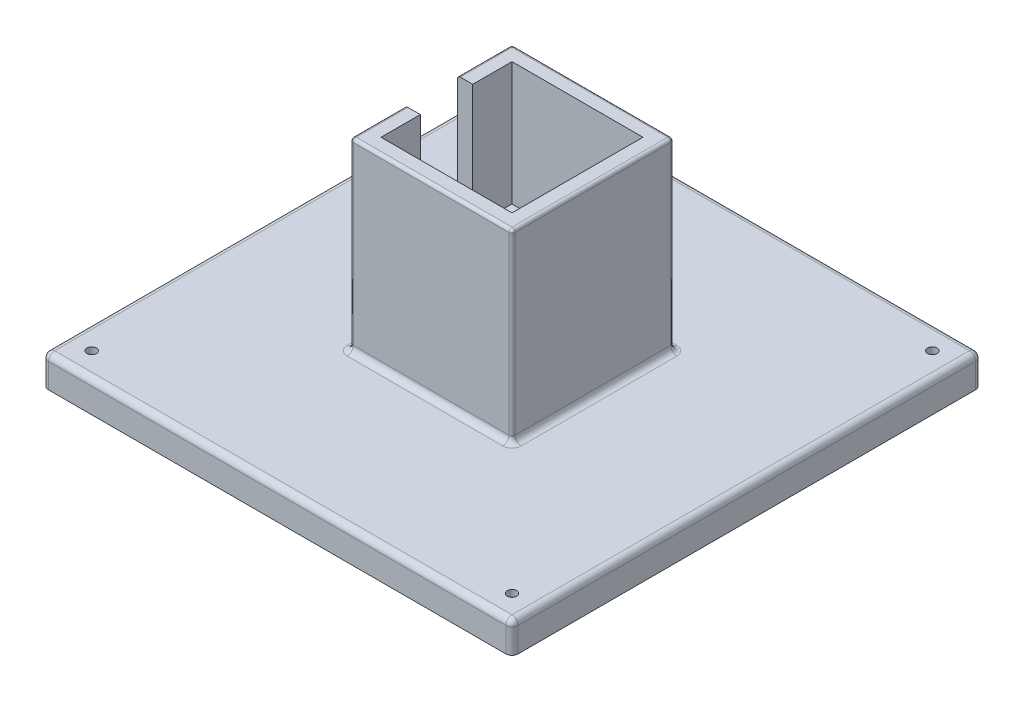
SolidWorks part; units mm, degrees
ref_plane "Front Plane" through (0, 0, 0) normal (0, 0, 1) x (1, 0, 0)
ref_plane "Top Plane" through (0, 0, 0) normal (0, 1, 0) x (1, 0, 0)
ref_plane "Right Plane" through (0, 0, 0) normal (1, 0, 0) x (0, 0, -1)
sketch "Sketch1" plane through (0, 0, 0) normal (0, 1, 0) x (1, 0, 0)
  line L0 (-26.25, -26.25) -> (-26.25, 26.25)
  line L1 (-21.25, -21.25) -> (21.25, -21.25)
  line L2 (-21.25, -21.25) -> (-21.25, 21.25)
  line L3 (-21.25, 21.25) -> (21.25, 21.25)
  line L4 (21.25, -21.25) -> (21.25, 21.25)
  line L5 (-21.25, -21.25) -> (21.25, 21.25) construction
  line L6 (-21.25, 21.25) -> (21.25, -21.25) construction
  line L7 (-26.25, 26.25) -> (26.25, 26.25)
  line L8 (26.25, -26.25) -> (26.25, 26.25)
  line L9 (-26.25, -26.25) -> (26.25, -26.25)
  point P0 (0, 0)
  dimension "D1" = 42.5
  dimension "D2" = 42.5
  dimension "D3" = 5
extrude "Boss-Extrude1" add sketch "Sketch1" along normal blind 60
ref_plane "Plane1" through (0, 5, 0) normal (0, 1, 0) x (1, 0, 0)
sketch "Sketch4" plane through (0, 5, 0) normal (0, 1, 0) x (1, 0, 0)
  line L1 (-21.25, -21.25) -> (21.25, -21.25)
  line L2 (-21.25, -21.25) -> (-21.25, 21.25)
  line L3 (-21.25, 21.25) -> (21.25, 21.25)
  line L4 (21.25, -21.25) -> (21.25, 21.25)
  line L5 (-21.25, -21.25) -> (21.25, 21.25) construction
  line L6 (-21.25, 21.25) -> (21.25, -21.25) construction
  circle A0 centre (0, 0) radius 2.69
  point P0 (0, 0)
  dimension "D1" = 5.38
extrude "Boss-Extrude3" add sketch "Sketch4" along normal blind 15
sketch "Sketch6" plane through (0, 5, 0) normal (0, -1, 0) x (1, 0, 0)
  line L1 (-21.25, -21.25) -> (21.25, -21.25)
  line L2 (-21.25, -21.25) -> (-21.25, 21.25)
  line L3 (-21.25, 21.25) -> (21.25, 21.25)
  line L4 (21.25, -21.25) -> (21.25, 21.25)
extrude "Boss-Extrude6" add sketch "Sketch6" along normal blind 5
sketch "Sketch8" plane through (0, 20, 0) normal (0, 1, 0) x (1, 0, 0)
  line L0 (0, 21.25) -> (0, -21.25) construction
  line L1 (21.25, 21.25) -> (-21.25, 21.25) construction
  line L2 (-21.25, -21.25) -> (21.25, -21.25) construction
  line L3 (-21.25, 0) -> (21.25, 0) construction
  line L4 (-21.25, 21.25) -> (-21.25, -21.25) construction
  line L5 (21.25, -21.25) -> (21.25, 21.25) construction
  circle A0 centre (-15.5, 15.5) radius 1.5
  circle A1 centre (15.5, 15.5) radius 1.5
  circle A2 centre (15.5, -15.5) radius 1.5
  circle A3 centre (-15.5, -15.5) radius 1.5
  dimension "D1" = 3
  dimension "D2" = 15.5
  dimension "D3" = 15.5
extrude "Cut-Extrude2" cut sketch "Sketch8" against normal blind 4.5 contours A0 | A1 | A2 | A3
thread "Thread1" pitch 0.5 start angle 0, offset 0, length 4.5, pitch 0.5, diameter 3
ref_plane "Plane4" through (-17, 20, -15.5) normal (0, 0, 1) x (-1, 0, 0)
sketch "Thread Profile3" plane through (-17, 20, -15.5) normal (0, 0, 1) x (-1, 0, 0)
  line L0 (0, 0) -> (0, 0.5) construction
  line L1 (0, 0) -> (0.2706, 0.1562)
  line L2 (0.2706, 0.1562) -> (0.2706, 0.2187)
  line L3 (0.2706, 0.2187) -> (0, 0.375)
  line L4 (0.2706, 0.1875) -> (0, 0.1875) construction
  line L11 (0, 0) -> (0, 0.375)
  point P2 (0, 0)
  dimension "Pitch" = 0.5
  dimension "Profile_Angle" = 60
  dimension "Profile_Land" = 0.0625
  dimension "Profile_Height" = 0.2706
thread "Thread2" pitch 0.5 start angle 0, offset 0, length 4.5, pitch 0.5, diameter 3
ref_plane "Plane5" through (14, 20, -15.5) normal (0, 0, 1) x (-1, 0, 0)
sketch "Thread Profile4" plane through (14, 20, -15.5) normal (0, 0, 1) x (-1, 0, 0)
  line L0 (0, 0) -> (0, 0.5) construction
  line L1 (0, 0) -> (0.2706, 0.1562)
  line L2 (0.2706, 0.1562) -> (0.2706, 0.2187)
  line L3 (0.2706, 0.2187) -> (0, 0.375)
  line L4 (0.2706, 0.1875) -> (0, 0.1875) construction
  line L11 (0, 0) -> (0, 0.375)
  point P2 (0, 0)
  dimension "Pitch" = 0.5
  dimension "Profile_Angle" = 60
  dimension "Profile_Land" = 0.0625
  dimension "Profile_Height" = 0.2706
thread "Thread3" pitch 0.5 start angle 0, offset 0, length 4.5, pitch 0.5, diameter 3
ref_plane "Plane6" through (-17, 20, 15.5) normal (0, 0, 1) x (-1, 0, 0)
sketch "Thread Profile5" plane through (-17, 20, 15.5) normal (0, 0, 1) x (-1, 0, 0)
  line L0 (0, 0) -> (0, 0.5) construction
  line L1 (0, 0) -> (0.2706, 0.1562)
  line L2 (0.2706, 0.1562) -> (0.2706, 0.2187)
  line L3 (0.2706, 0.2187) -> (0, 0.375)
  line L4 (0.2706, 0.1875) -> (0, 0.1875) construction
  line L11 (0, 0) -> (0, 0.375)
  point P2 (0, 0)
  dimension "Pitch" = 0.5
  dimension "Profile_Angle" = 60
  dimension "Profile_Land" = 0.0625
  dimension "Profile_Height" = 0.2706
thread "Thread4" pitch 0.5 start angle 0, offset 0, length 4.5, pitch 0.5, diameter 3
ref_plane "Plane7" through (14, 20, 15.5) normal (0, 0, 1) x (-1, 0, 0)
sketch "Thread Profile6" plane through (14, 20, 15.5) normal (0, 0, 1) x (-1, 0, 0)
  line L0 (0, 0) -> (0, 0.5) construction
  line L1 (0, 0) -> (0.2706, 0.1562)
  line L2 (0.2706, 0.1562) -> (0.2706, 0.2187)
  line L3 (0.2706, 0.2187) -> (0, 0.375)
  line L4 (0.2706, 0.1875) -> (0, 0.1875) construction
  line L11 (0, 0) -> (0, 0.375)
  point P2 (0, 0)
  dimension "Pitch" = 0.5
  dimension "Profile_Angle" = 60
  dimension "Profile_Land" = 0.0625
  dimension "Profile_Height" = 0.2706
fillet "Fillet1" radius 1 8 edges at (-26.25, 60, 0) (0, 60, 26.25) (26.25, 60, 0) (0, 60, -26.25) (26.25, 30, -26.25) (26.25, 30, 26.25) (-26.25, 30, 26.25) (-26.25, 30, -26.25)
sketch "Sketch10" plane through (0, 20, 0) normal (0, 1, 0) x (1, 0, 0)
  circle A0 centre (0, 0) radius 8.19
  dimension "D1" = 16.38
extrude "Cut-Extrude4" cut sketch "Sketch10" against normal blind 5
sketch "Sketch11" plane through (0, 60, 0) normal (0, 1, 0) x (1, 0, 0)
  line L0 (-26.25, -25.25) -> (-26.25, 25.25) construction
  line L1 (-21.25, 8.5) -> (-26.25, 8.5)
  line L2 (-21.25, 8.5) -> (-21.25, -8.5)
  line L3 (-21.25, -8.5) -> (-26.25, -8.5)
  line L4 (-26.25, 8.5) -> (-26.25, -8.5)
  point P4 (-21.25, 0)
  dimension "D2" = 17
  dimension "D3" = 5
extrude "Cut-Extrude5" cut sketch "Sketch11" against normal blind 36
sketch "Sketch12" plane through (0, 0, 0) normal (0, -1, 0) x (1, 0, 0)
  line L1 (-76.2, -76.2) -> (76.2, -76.2)
  line L2 (-76.2, -76.2) -> (-76.2, 76.2)
  line L3 (-76.2, 76.2) -> (76.2, 76.2)
  line L4 (76.2, -76.2) -> (76.2, 76.2)
  line L5 (-76.2, -76.2) -> (76.2, 76.2) construction
  line L6 (-76.2, 76.2) -> (76.2, -76.2) construction
  point P0 (0, 0)
  dimension "D1" = 152.4
  dimension "D2" = 152.4
extrude "Boss-Extrude7" add sketch "Sketch12" along normal blind 10
fillet "Fillet2" radius 2 16 edges at (-25.9571, 0, -25.9571) (-26.25, 0, 0) (-25.9571, 0, 25.9571) (0, 0, 26.25) (25.9571, 0, 25.9571) (26.25, 0, 0) (25.9571, 0, -25.9571) (0, 0, -26.25) (0, 0, 76.2) (-76.2, 0, 0) (0, 0, -76.2) (76.2, 0, 0) (-76.2, -5, -76.2) (76.2, -5, -76.2) (76.2, -5, 76.2) (-76.2, -5, 76.2)
sketch "Sketch13" plane through (0, 0, 0) normal (0, 1, 0) x (1, 0, 0)
  line L0 (-74.2, 76.2) -> (74.2, 76.2) construction
  line L1 (-76.2, -74.2) -> (-76.2, 74.2) construction
  line L2 (0, -38.5) -> (0, 38.5) construction
  line L3 (-38.5, 0) -> (38.5, 0) construction
  circle A0 centre (-68.2, 68.2) radius 1.55
  circle A1 centre (68.2, 68.2) radius 1.55
  circle A2 centre (68.2, -68.2) radius 1.55
  circle A3 centre (-68.2, -68.2) radius 1.55
  dimension "D1" = 3.1
  dimension "D2" = 8
  dimension "D3" = 8
extrude "Cut-Extrude6" cut sketch "Sketch13" against normal up to next
